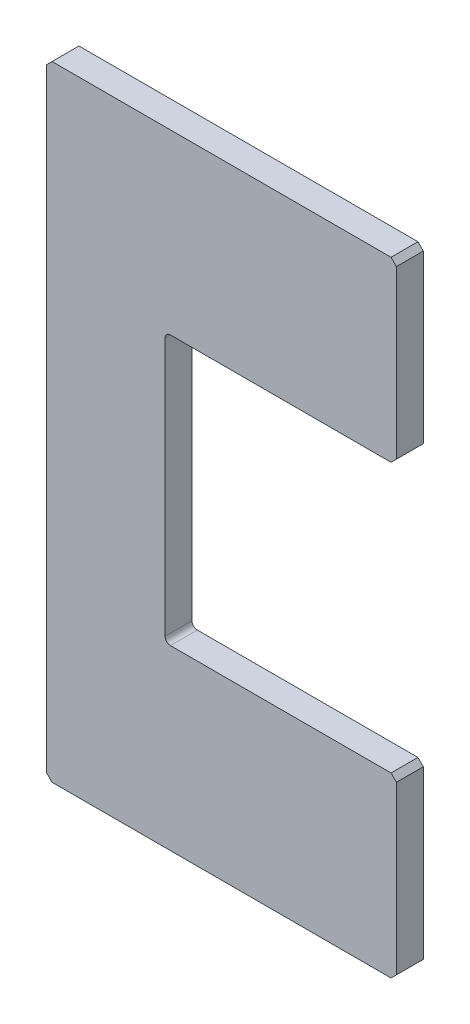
SolidWorks part; units mm, degrees
ref_plane "前视基准面" through (0, 0, 0) normal (0, 0, 1) x (1, 0, 0)
ref_plane "上视基准面" through (0, 0, 0) normal (0, 1, 0) x (1, 0, 0)
ref_plane "右视基准面" through (0, 0, 0) normal (1, 0, 0) x (0, 0, -1)
other "Configuration Table"
sketch "草图1" plane through (0, 0, 0) normal (0, 0, 1) x (1, 0, 0)
  line L0 (0, 0) -> (6.5, 0)
  line L1 (6.5, 0) -> (6.5, -3.3)
  line L2 (6.5, -3.3) -> (2.2, -3.3)
  line L3 (2.2, -3.3) -> (2.2, -8.3)
  line L4 (2.2, -8.3) -> (6.5, -8.3)
  line L5 (6.5, -8.3) -> (6.5, -11.6)
  line L6 (6.5, -11.6) -> (0, -11.6)
  line L7 (0, -11.6) -> (0, 0)
  dimension "D1" = 6.5
  dimension "D2" = 3.3
  dimension "D3" = 11.6
  dimension "D4" = 4.3
extrude "凸台-拉伸1" add sketch "草图1" along normal blind 0.5
fillet "圆角1" radius 0.1 2 edges at (2.2, -8.3, 0.25) (2.2, -3.3, 0.25)
chamfer "倒角1" distance 0.1 angle 45 6 edges at (0, 0, 0.25) (0, -11.6, 0.25) (6.5, 0, 0.25) (6.5, -8.3, 0.25) (6.5, -3.3, 0.25) (6.5, -11.6, 0.25)
